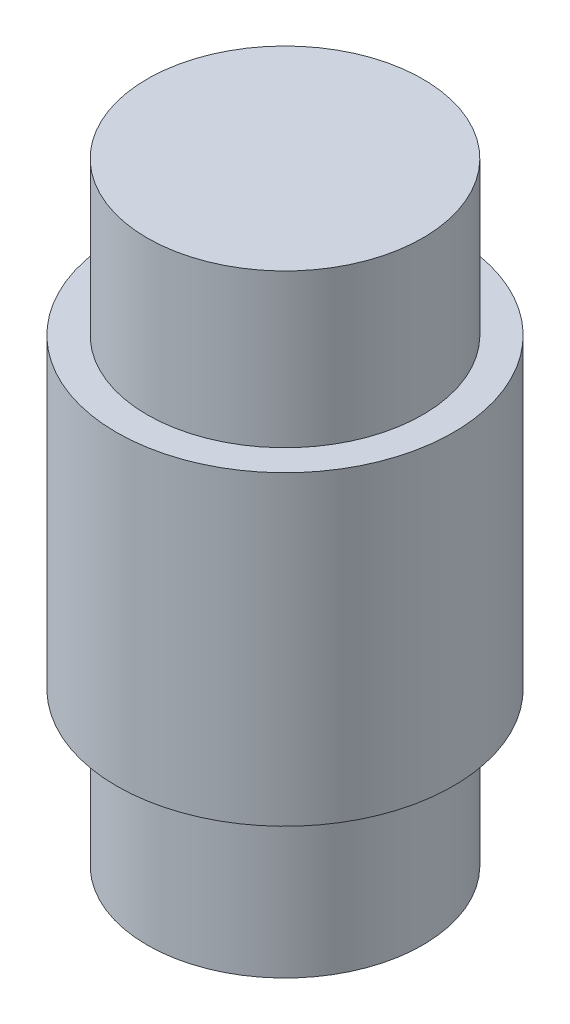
SolidWorks part; units mm, degrees
ref_plane "Front Plane" through (0, 0, 0) normal (0, 0, 1) x (1, 0, 0)
ref_plane "Top Plane" through (0, 0, 0) normal (0, 1, 0) x (1, 0, 0)
ref_plane "Right Plane" through (0, 0, 0) normal (1, 0, 0) x (0, 0, -1)
sketch "Sketch1" plane through (0, 0, 0) normal (0, 1, 0) x (1, 0, 0)
  circle A0 centre (0, 0) radius 5.715
  dimension "D1" = 11.43
extrude "Boss-Extrude1" add sketch "Sketch1" along normal blind 6.35
sketch "Sketch2" plane through (0, 6.35, 0) normal (0, 1, 0) x (1, 0, 0)
  circle A0 centre (0, 0) radius 6.985
  dimension "D1" = 13.97
extrude "Boss-Extrude2" add sketch "Sketch2" along normal blind 12.7
sketch "Sketch3" plane through (0, 19.05, 0) normal (0, 1, 0) x (1, 0, 0)
  circle A0 centre (0, 0) radius 5.715
  dimension "D1" = 11.43
extrude "Boss-Extrude3" add sketch "Sketch3" along normal blind 6.35
